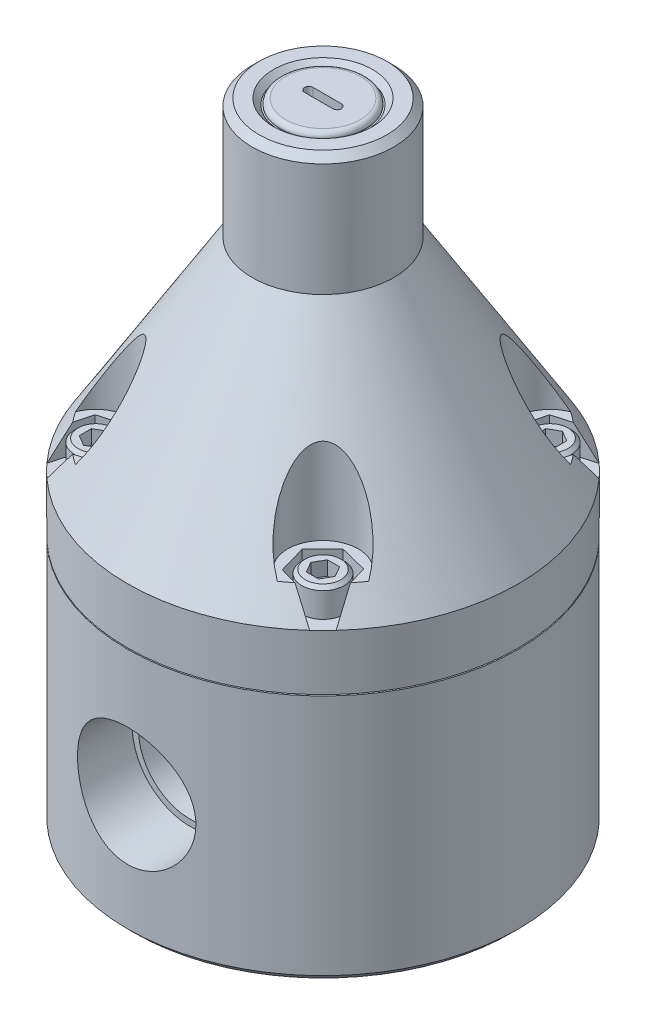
SolidWorks part; units mm, degrees
ref_plane "Front Plane" through (0, 0, 0) normal (0, 0, 1) x (1, 0, 0)
ref_plane "Top Plane" through (0, 0, 0) normal (0, 1, 0) x (1, 0, 0)
ref_plane "Right Plane" through (0, 0, 0) normal (1, 0, 0) x (0, 0, -1)
sketch "Sketch1" plane through (0, 0, 0) normal (0, 1, 0) x (1, 0, 0)
  circle A0 centre (0, 0) radius 43.815
  dimension "D1" = 87.63
extrude "Extrude1" add sketch "Sketch1" along normal blind 140.97
sketch "Sketch2" plane through (0, 0, 0) normal (0, 0, 1) x (1, 0, 0)
  line L0 (0, 0) -> (0, 140.97) construction
  line L1 (43.815, 140.97) -> (-43.815, 140.97) construction
  line L2 (-43.815, 56.134) -> (-43.815, 68.58)
  line L3 (-43.815, 56.134) -> (-30.226, 56.134)
  line L4 (-30.226, 56.134) -> (-30.226, 55.88)
  line L6 (-30.226, 55.88) -> (-49.4473, 55.88)
  line L7 (-49.4473, 55.88) -> (-49.4473, 147.034)
  line L8 (-49.4473, 147.034) -> (-15.875, 147.034)
  line L9 (-15.875, 147.034) -> (-15.875, 114.046)
  line L10 (-15.875, 114.046) -> (-43.815, 68.58)
  line L12 (-43.815, 0) -> (43.815, 0) construction
  dimension "D1" = 43.815
  dimension "D2" = 55.88
  dimension "D3" = 0.254
  dimension "D4" = 30.226
  dimension "D5" = 15.875
  dimension "D6" = 68.58
  dimension "D7" = 26.924
revolve "Cut-Revolve1" cut sketch "Sketch2" angle 360 about L0
ref_plane "Plane1" through (0, 140.97, 0) normal (0, 1, 0) x (-1, 0, 0)
sketch "Sketch3" plane through (0, 140.97, 0) normal (0, 1, 0) x (-1, 0, 0)
  circle A0 centre (0, 0) radius 11.1125
  dimension "D1" = 22.225
extrude "Extrude2" cut sketch "Sketch3" against normal blind 1.27 draft 45
chamfer "Chamfer1" distance 1.5748 angle 45 2 edges at (0, 0, 43.815) (0, 140.97, 15.875)
sketch "Sketch4" plane through (0, 140.97, 0) normal (0, 1, 0) x (-1, 0, 0)
  circle A0 centre (0, 0) radius 9.525
  dimension "D1" = 19.05
extrude "Extrude3" add sketch "Sketch4" against normal up to surface (1.27 mm away)
fillet "Fillet1" radius 1.143 1 edges at (0, 140.97, 9.525)
sketch "Sketch5" plane through (0, 140.97, 0) normal (0, 1, 0) x (-1, 0, 0)
  line L0 (-3.175, 0) -> (3.175, 0) construction
  line L1 (3.175, 0.9652) -> (-3.175, 0.9652)
  line L2 (-3.175, -0.9652) -> (3.175, -0.9652)
  arc A0 (-3.175, 0.9652) -> (-3.175, -0.9652) centre (-3.175, 0) ccw
  arc A1 (3.175, -0.9652) -> (3.175, 0.9652) centre (3.175, 0) ccw
  dimension "D1" = 3.175
  dimension "D2" = 6.35
  dimension "D3" = 0.9652
  dimension "D4" = 0.9652
extrude "Extrude4" cut sketch "Sketch5" against normal blind 3.302 draft 1
ref_plane "Plane2" through (0, 74.93, 0) normal (0, 1, 0) x (-1, 0, 0)
sketch "Sketch6" plane through (0, 74.93, 0) normal (0, 1, 0) x (-1, 0, 0)
  line L0 (0, 0) -> (-43.815, 0) construction
  line L1 (0, 0) -> (-30.9819, 30.9819) construction
  circle A0 centre (0, 0) radius 43.815 construction
  circle A1 centre (0, 0) radius 36.0045 construction
  circle A2 centre (-25.459, 25.459) radius 7.9375
  dimension "D1" = 72.009
  dimension "D2" = 15.875
extrude "Extrude5" cut sketch "Sketch6" along normal blind 22.86
sketch "Sketch8" plane through (0, 74.93, 0) normal (0, 1, 0) x (-1, 0, 0)
  line L0 (0, 0) -> (-30.9819, 30.9819) construction
  line L1 (-30.9819, 19.758) -> (-19.9362, 31.1601) construction
  line L2 (-30.9819, 30.9819) -> (-39.3973, 39.3973) construction
  line L3 (-29.9486, 20.8246) -> (-23.6903, 19.2537)
  line L4 (-23.6903, 19.2537) -> (-19.2007, 23.8882)
  line L5 (-19.2007, 23.8882) -> (-20.9694, 30.0935)
  line L9 (-29.9486, 20.8246) -> (-33.5917, 33.5917)
  line L10 (-33.5917, 33.5917) -> (-20.9694, 30.0935)
  line L12 (-27.2278, 31.6643) -> (-31.7174, 27.0299)
  line L13 (-20.9694, 30.0935) -> (-27.2278, 31.6643)
  line L14 (-31.7174, 27.0299) -> (-29.9486, 20.8246)
  circle A0 centre (0, 0) radius 43.815 construction
  arc A1 (-32.876, 22.6318) -> (-22.6318, 32.876) centre (-25.459, 25.459) ccw construction
  arc A2 (-32.876, 22.6318) -> (-22.6318, 32.876) centre (-25.459, 25.459) ccw construction
  circle A3 centre (-25.459, 25.459) radius 5.588 construction
extrude "Extrude6" cut sketch "Sketch8" against normal blind 6.35
pattern_circular "CirPattern1" count 4 over 360 about axis through (0, 0, 0) along (0, 1, 0) of "Extrude5", "Extrude6"
sketch "Sketch9" plane through (0, 74.93, 0) normal (0, 1, 0) x (-1, 0, 0)
  line L0 (0, 0) -> (-25.459, 25.459) construction
  circle A0 centre (-25.459, 25.459) radius 4.7625
  dimension "D1" = 9.525
extrude "Extrude7" add sketch "Sketch9" against normal up to surface (6.35 mm away)
sketch "Sketch10" plane through (0, 74.93, 0) normal (0, 1, 0) x (-1, 0, 0)
  line L1 (-28.1871, 25.459) -> (-26.8231, 23.0964)
  line L2 (-26.8231, 23.0964) -> (-24.095, 23.0964)
  line L3 (-24.095, 23.0964) -> (-22.7309, 25.459)
  line L4 (-22.7309, 25.459) -> (-24.095, 27.8216)
  line L5 (-24.095, 27.8216) -> (-26.8231, 27.8216)
  line L6 (-26.8231, 27.8216) -> (-28.1871, 25.459)
  circle A0 centre (-25.459, 25.459) radius 2.3626 construction
extrude "Extrude8" cut sketch "Sketch10" against normal blind 3.175
pattern_circular "CirPattern2" count 4 over 360 about axis through (0, 0, 0) along (0, 1, 0) of "Extrude7", "Extrude8"
chamfer "Chamfer2" distance 0.762 angle 45 4 edges at (-25.459, 74.93, -30.2215) (30.2215, 74.93, -25.459) (25.459, 74.93, 30.2215) (-30.2215, 74.93, 25.459)
ref_plane "Plane3" through (0, 0, 43.815) normal (0, 0, 1) x (1, 0, 0)
sketch "Sketch11" plane through (0, 0, 43.815) normal (0, 0, 1) x (1, 0, 0)
  line L0 (0, -6.7756) -> (0, 147.7456) construction
  line L1 (-48.3989, 25.4) -> (47.2148, 25.4) construction
  line L2 (-42.2402, 0) -> (42.2402, 0) construction
  dimension "D1" = 25.4
hole_wizard "3/4 NPT Tapped Hole2" positions "3DSketch3" profile "Sketch14" size "3/4" standard "Ansi Inch"
sketch3d "3DSketch3"
  line L0 (0, -6.7756, 43.815) -> (0, 147.7456, 43.815) construction
  point P0 (0, 27.432, 43.815)
sketch "Sketch14" plane through (0, 27.432, 43.815) normal (1, 0, 0) x (0, -1, 0)
  line L0 (0, 0) -> (0, 27.88)
  line L1 (11.5062, 23.114) -> (0, 27.88)
  line L2 (-11.5062, 23.114) -> (0, 27.88) construction
  line L3 (11.5062, 23.114) -> (11.5062, 13.97)
  line L4 (11.5062, 13.97) -> (12.9142, 13.97)
  line L5 (12.9142, 13.97) -> (13.3325, 0)
  line L6 (-12.9142, 13.97) -> (-13.3325, 0) construction
  line L7 (13.3325, 0) -> (0, 0)
  line L8 (0, -6.35) -> (0, 107.95) construction
  line L11 (-11.5062, 13.97) -> (-12.9142, 13.97) construction
  dimension "Tap Drill Dia." = 23.0124
  dimension "Tap Drill Depth" = 23.114
  dimension "Thread Dia." = 26.665
  dimension "Thread Angle" = 3.43
  dimension "Thread Depth" = 13.97
  dimension "Drill Angle" = 135
mirror "Mirror1" about plane through (0, 0, 0) normal (0, 0, 1) of "3/4 NPT Tapped Hole2"
sketch "Sketch16" plane through (0, 0, 0) normal (0, 1, 0) x (1, 0, 0)
  line L0 (-42.2402, 0) -> (42.2402, 0) construction
  circle A0 centre (0, 0) radius 42.2402 construction
hole_wizard "3/4 NPT Tapped Hole1" positions "3DSketch5" profile "Sketch17" size "3/4" standard "Ansi Inch"
sketch3d "3DSketch5"
  point P0 (0, 0, 0)
  point P4 (0, 0, 0)
sketch "Sketch17" plane through (0, 0, 0) normal (1, 0, 0) x (0, 0, -1)
  line L0 (0, 0) -> (0, 25.9756)
  line L1 (4.7625, 23.114) -> (0, 25.9756)
  line L2 (-4.7625, 23.114) -> (0, 25.9756) construction
  line L3 (4.7625, 23.114) -> (4.7625, 13.97)
  line L4 (4.7625, 13.97) -> (12.9142, 13.97)
  line L5 (12.9142, 13.97) -> (13.3325, 0)
  line L6 (-12.9142, 13.97) -> (-13.3325, 0) construction
  line L7 (13.3325, 0) -> (0, 0)
  line L8 (0, -6.35) -> (0, 107.95) construction
  line L11 (-4.7625, 13.97) -> (-12.9142, 13.97) construction
  dimension "Tap Drill Dia." = 9.525
  dimension "Tap Drill Depth" = 23.114
  dimension "Thread Dia." = 26.665
  dimension "Thread Angle" = 3.43
  dimension "Thread Depth" = 13.97
  dimension "Drill Angle" = 118
